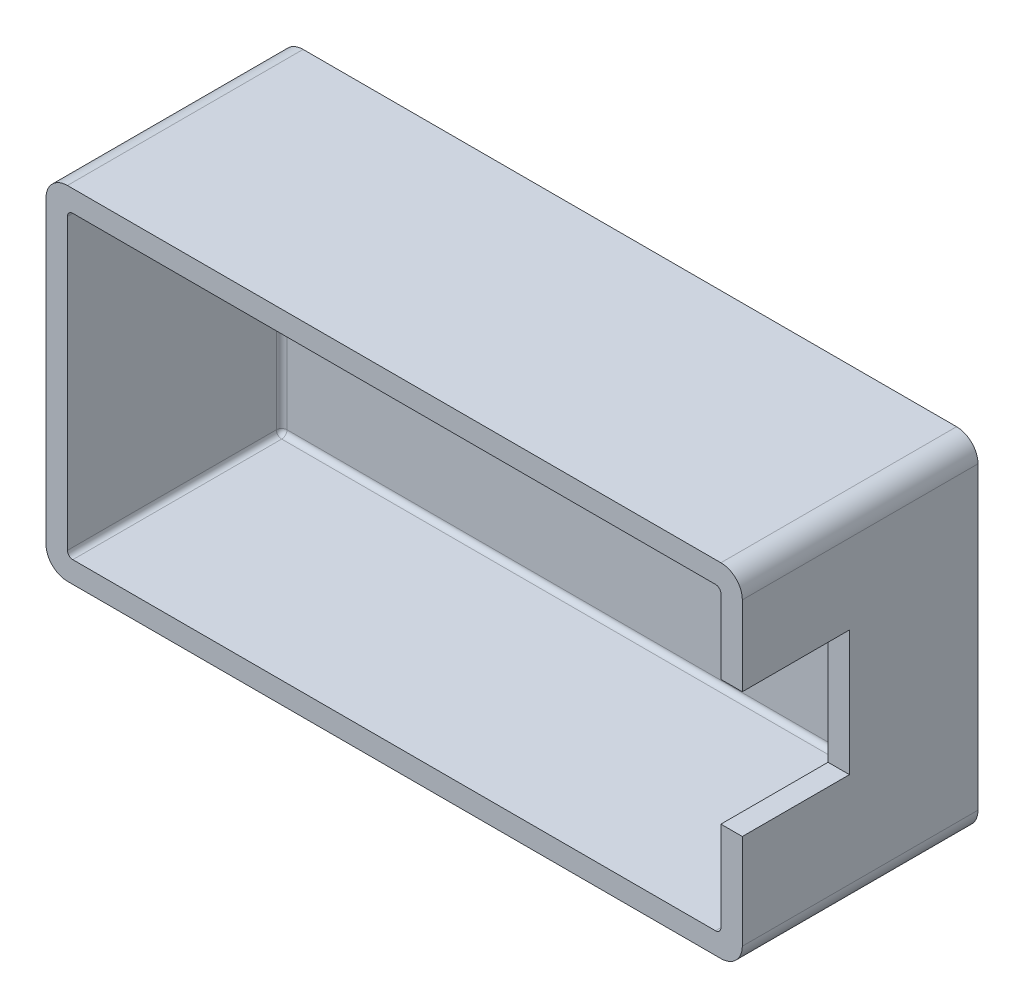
SolidWorks part; units mm, degrees
ref_plane "Plan de face" through (0, 0, 0) normal (0, 0, 1) x (1, 0, 0)
ref_plane "Plan de dessus" through (0, 0, 0) normal (0, 1, 0) x (1, 0, 0)
ref_plane "Plan de droite" through (0, 0, 0) normal (1, 0, 0) x (0, 0, -1)
sketch "Esquisse1" plane through (0, 0, 0) normal (0, 0, 1) x (1, 0, 0)
  line L1 (0, 0) -> (65, 0)
  line L2 (0, 0) -> (0, 32)
  line L3 (0, 32) -> (65, 32)
  line L4 (65, 0) -> (65, 32)
  dimension "D1" = 32
  dimension "D2" = 65
extrude "Boss.-Extru.1" add sketch "Esquisse1" along normal blind 2
sketch "Esquisse2" plane through (0, 0, 2) normal (0, 0, 1) x (1, 0, 0)
  line L0 (2, 30) -> (2, 2)
  line L1 (2, 2) -> (63, 2)
  line L2 (63, 2) -> (63, 30)
  line L3 (63, 30) -> (2, 30)
  line L4 (0, 32) -> (0, 0)
  line L5 (0, 0) -> (65, 0)
  line L6 (65, 0) -> (65, 32)
  line L7 (65, 32) -> (0, 32)
  line L8 (0, 32) -> (0, 0)
  line L9 (0, 0) -> (65, 0)
  line L10 (65, 0) -> (65, 32)
  line L11 (65, 32) -> (0, 32)
  dimension "D1" = 0
  dimension "D2" = 2
extrude "Boss.-Extru.2" add sketch "Esquisse2" along normal blind 20
sketch "Esquisse3" plane through (63, 0, 0) normal (-1, 0, 0) x (0, 0, 1)
  line L0 (22, 2) -> (22, 30) construction
  line L1 (22, 22.5704) -> (12, 22.5704)
  line L2 (22, 22.5704) -> (22, 10.8704)
  line L3 (22, 10.8704) -> (12, 10.8704)
  line L4 (12, 22.5704) -> (12, 10.8704)
  dimension "D1" = 11.7
  dimension "D2" = 10
extrude "Enlèv. mat.-Extru.1" cut sketch "Esquisse3" against normal blind 10
fillet "Congé1" radius 0.5 8 edges at (2, 16, 2) (2, 2, 12) (32.5, 2, 2) (63, 2, 12) (63, 16, 2) (32.5, 30, 2) (63, 30, 12) (2, 30, 12)
fillet "Congé2" radius 2 4 edges at (0, 0, 11) (65, 0, 11) (65, 32, 11) (0, 32, 11)
